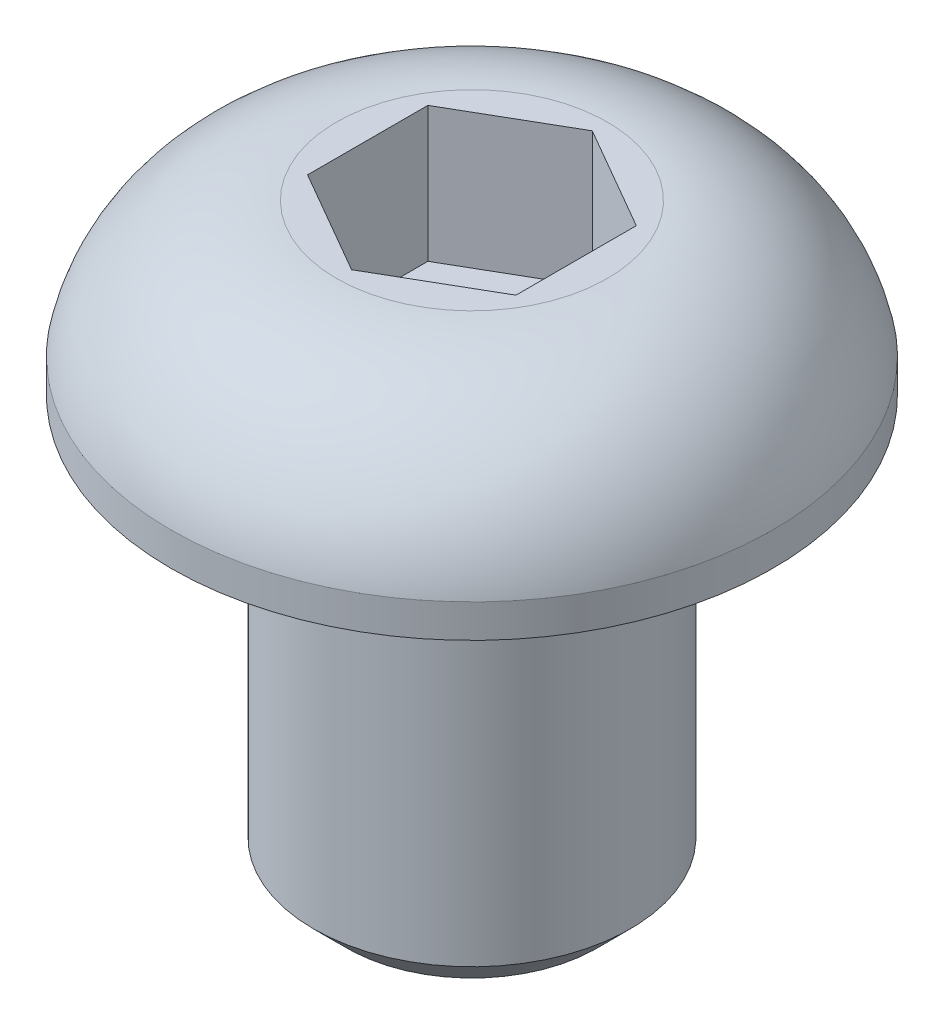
SolidWorks part; units mm, degrees
ref_plane "Plane1" through (0, 0, 0) normal (0, 0, 1) x (1, 0, 0)
ref_plane "Plane2" through (0, 0, 0) normal (0, 1, 0) x (1, 0, 0)
ref_plane "Plane3" through (0, 0, 0) normal (1, 0, 0) x (0, 0, -1)
sketch "Sketch1" plane through (0, 0, 0) normal (0, 0, 1) x (1, 0, 0)
  line L0 (0, 0) -> (2.0637, 0)
  line L1 (2.413, -2.5654) -> (4.5847, -2.5654)
  line L2 (4.5847, -2.0574) -> (4.5847, -2.5654)
  line L4 (2.413, -2.5654) -> (2.413, -8.9154)
  line L5 (0, 25.4) -> (0, -50.8) construction
  line L6 (2.413, -8.9154) -> (0, -8.9154)
  line L7 (0, 0) -> (0, -8.9154)
  arc A0 (2.0637, 0) -> (4.5847, -2.0574) centre (2.0637, -2.5732) cw
  dimension "FlatFace" = 0.508
  dimension "NominalDia" = 4.826
  dimension "CapDia" = 9.1694
  dimension "FlatDia" = 4.1275
revolve "Screw" add sketch "Sketch1" angle 360 about L5
sketch "Sketch2" plane through (0, 0, 0) normal (0, 1, 0) x (-1, 0, 0)
  line L0 (0, -5.08) -> (0, 5.08) construction
  line L1 (11.7475, 0) -> (-14.9225, 0) construction
  line L2 (-1.5875, -0.9165) -> (-1.5875, 0.9165)
  line L3 (0, 1.8331) -> (-1.5875, 0.9165)
  line L4 (0, 1.8331) -> (1.5875, 0.9165)
  line L5 (1.5875, -0.9165) -> (1.5875, 0.9165)
  line L6 (0, -1.8331) -> (-1.5875, -0.9165)
  line L7 (0, -1.8331) -> (1.5875, -0.9165)
  point P8 (-1.5875, 0)
  dimension "D1" = 120
extrude "HexCut" cut sketch "Sketch2" against normal blind 2.0574
sketch "Sketch3" plane through (0, -2.5654, 0) normal (0, -1, 0) x (1, 0, 0)
  circle A0 centre (0, 0) radius 4.5847 construction
  circle A1 centre (0, 0) radius 4.5847 construction
  point P0 (0, 4.5847)
  point P1 (0, -4.5847)
  point P6 (4.5847, 0)
  point P7 (-4.5847, 0)
sketch "Sketch4" plane through (0, -8.9154, 0) normal (0, -1, 0) x (1, 0, 0)
  circle A0 centre (0, 0) radius 1.1811
  dimension "D1" = 2.3622
extrude "Cut-Extrude1" cut sketch "Sketch4" against normal through all
chamfer "Chamfer1" distance 0.508 angle 45 1 edges at (0, -8.9154, 2.413)
equation "\"FlatDia@Sketch1\"=\"HexWidth@Sketch2\"*1.3"
equation "\"Depth@HexCut\"=\"CapHeight@Sketch1\"-\"FlatFace@Sketch1\""
